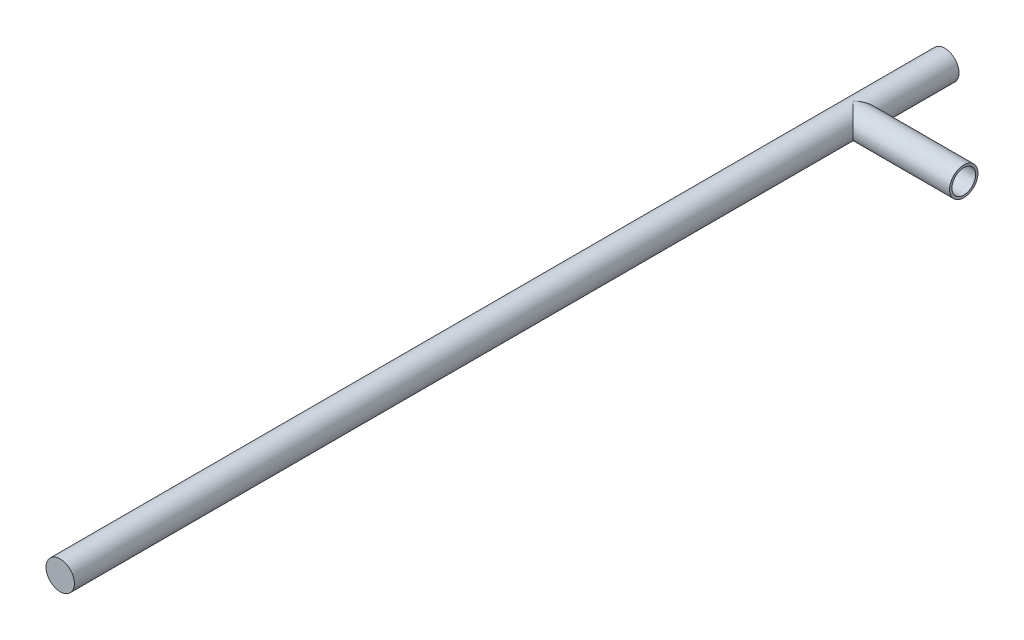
SolidWorks part; units mm, degrees
ref_plane "Alzado" through (0, 0, 0) normal (0, 0, 1) x (1, 0, 0)
ref_plane "Planta" through (0, 0, 0) normal (0, 1, 0) x (1, 0, 0)
ref_plane "Vista lateral" through (0, 0, 0) normal (1, 0, 0) x (0, 0, -1)
sketch "Croquis1" plane through (0, 0, 0) normal (0, 0, 1) x (1, 0, 0)
  circle A0 centre (0, 0) radius 9
  dimension "D1" = 18
extrude "Saliente-Extruir1" add sketch "Croquis1" along normal blind 560
sketch "Croquis3" plane through (0, 0, 0) normal (1, 0, 0) x (0, 0, -1)
  line L0 (-560, 9) -> (-560, -9) construction
  circle A0 centre (-19.876, 0) radius 4.7625
  circle A1 centre (-45.276, 0) radius 4.7625
  circle A2 centre (-70.676, 0) radius 4.7625
  circle A3 centre (-96.076, 0) radius 4.7625
  circle A4 centre (-121.476, 0) radius 4.7625
  circle A5 centre (-146.876, 0) radius 4.7625
  circle A6 centre (-172.276, 0) radius 4.7625
  circle A7 centre (-197.676, 0) radius 4.7625
  circle A8 centre (-223.076, 0) radius 4.7625
  circle A9 centre (-248.476, 0) radius 4.7625
  circle A10 centre (-273.876, 0) radius 4.7625
  circle A11 centre (-299.276, 0) radius 4.7625
  circle A12 centre (-324.676, 0) radius 4.7625
  circle A13 centre (-350.076, 0) radius 4.7625
  circle A14 centre (-375.476, 0) radius 4.7625
  circle A15 centre (-400.876, 0) radius 4.7625
  circle A16 centre (-426.276, 0) radius 4.7625
  circle A17 centre (-451.676, 0) radius 4.7625
  circle A18 centre (-477.076, 0) radius 4.7625
  circle A19 centre (-502.476, 0) radius 4.7625
  circle A20 centre (-527.876, 0) radius 4.7625
  circle A21 centre (-553.276, 0) radius 4.7625
  dimension "D1" = 9.525
  dimension "D2" = 19.876
  dimension "D4" = 6.724
  dimension "D3" = 22
extrude "Cortar-Extruir1" cut sketch "Croquis3" against normal up to next
sketch "Croquis4" plane through (0, 0, 0) normal (1, 0, 0) x (0, 0, -1)
  circle A0 centre (-58, 0) radius 9
  dimension "D2" = 18
  dimension "D1" = 58
extrude "Saliente-Extruir3" add sketch "Croquis4" along normal blind 70
ref_plane "Plano1" through (0, 0, 1.7) normal (0, 0, 1) x (1, 0, 0)
sketch "Croquis5" plane through (0, 0, 1.7) normal (0, 0, 1) x (1, 0, 0)
  circle A0 centre (0, 0) radius 7.5
  dimension "D1" = 15
extrude "Cortar-Extruir2" cut sketch "Croquis5" along normal blind 557
sketch "Croquis6" plane through (70, 0, 0) normal (1, 0, 0) x (0, 0, -1)
  circle A0 centre (-58, 0) radius 7.5
  dimension "D1" = 15
extrude "Cortar-Extruir3" cut sketch "Croquis6" against normal blind 70
